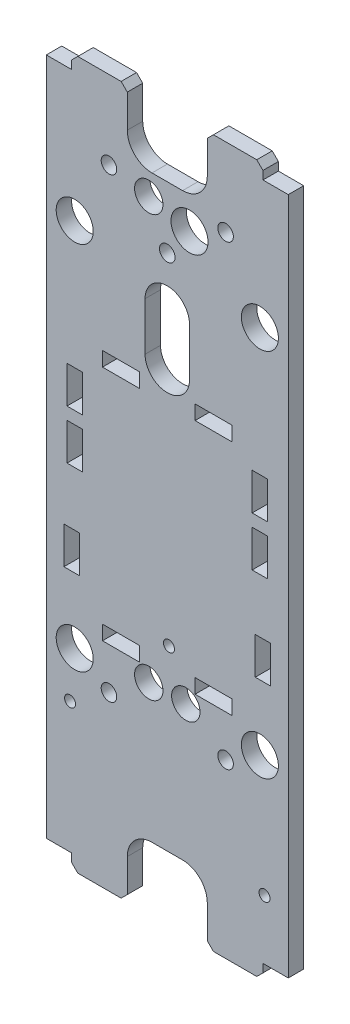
SolidWorks part; units mm, degrees
ref_plane "Front Plane" through (0, 0, 0) normal (0, 0, 1) x (1, 0, 0)
ref_plane "Top Plane" through (0, 0, 0) normal (0, 1, 0) x (1, 0, 0)
ref_plane "Right Plane" through (0, 0, 0) normal (1, 0, 0) x (0, 0, -1)
sketch "Sketch1" plane through (0, 0, 0) normal (0, 0, 1) x (1, 0, 0)
  line L1 (-24.892, 72.771) -> (24.892, 72.771)
  line L2 (-24.892, 72.771) -> (-24.892, -72.771)
  line L3 (-24.892, -72.771) -> (24.892, -72.771)
  line L4 (24.892, 72.771) -> (24.892, -72.771)
  line L5 (-24.892, 72.771) -> (24.892, -72.771) construction
  line L6 (-24.892, -72.771) -> (24.892, 72.771) construction
  point P0 (0, 0)
  dimension "D1" = 49.784
  dimension "D2" = 145.542
extrude "Boss-Extrude1" add sketch "Sketch1" along normal blind 3.175
sketch "Sketch2" plane through (0, 0, 0) normal (0, 0, -1) x (-1, 0, 0)
  line L0 (-24.892, 72.771) -> (24.892, 72.771) construction
  line L1 (-8.2296, 75.7428) -> (8.2296, 75.7428)
  line L2 (-8.2296, 75.7428) -> (-8.2296, 69.7992)
  line L3 (-8.2296, 69.7992) -> (8.2296, 69.7992)
  line L4 (8.2296, 75.7428) -> (8.2296, 69.7992)
  line L5 (-8.2296, 75.7428) -> (8.2296, 69.7992) construction
  line L6 (-8.2296, 69.7992) -> (8.2296, 75.7428) construction
  line L7 (0, 72.771) -> (0, -72.771) construction
  line L8 (-30.099, 75.7428) -> (-19.685, 75.7428)
  line L9 (-30.099, 75.7428) -> (-30.099, 69.7992)
  line L10 (-30.099, 69.7992) -> (-19.685, 69.7992)
  line L11 (-19.685, 75.7428) -> (-19.685, 69.7992)
  line L12 (-30.099, 75.7428) -> (-19.685, 69.7992) construction
  line L13 (-30.099, 69.7992) -> (-19.685, 75.7428) construction
  line L14 (24.892, -72.771) -> (-24.892, -72.771) construction
  line L15 (-24.892, 0) -> (24.892, 0) construction
  line L16 (-24.892, -72.771) -> (-24.892, 72.771) construction
  line L17 (24.892, 72.771) -> (24.892, -72.771) construction
  line L18 (30.099, 69.7992) -> (19.685, 75.7428) construction
  line L19 (30.099, 75.7428) -> (19.685, 69.7992) construction
  line L20 (19.685, 75.7428) -> (19.685, 69.7992)
  line L21 (30.099, 69.7992) -> (19.685, 69.7992)
  line L22 (30.099, 75.7428) -> (30.099, 69.7992)
  line L23 (30.099, 75.7428) -> (19.685, 75.7428)
  line L24 (30.099, -75.7428) -> (19.685, -69.7992) construction
  line L25 (30.099, -69.7992) -> (19.685, -75.7428) construction
  line L26 (-30.099, -69.7992) -> (-19.685, -75.7428) construction
  line L27 (-30.099, -75.7428) -> (-19.685, -69.7992) construction
  line L28 (-8.2296, -69.7992) -> (8.2296, -75.7428) construction
  line L29 (-8.2296, -75.7428) -> (8.2296, -69.7992) construction
  line L30 (30.099, -75.7428) -> (19.685, -75.7428)
  line L31 (30.099, -75.7428) -> (30.099, -69.7992)
  line L32 (30.099, -69.7992) -> (19.685, -69.7992)
  line L33 (19.685, -75.7428) -> (19.685, -69.7992)
  line L34 (-19.685, -75.7428) -> (-19.685, -69.7992)
  line L35 (-30.099, -69.7992) -> (-19.685, -69.7992)
  line L36 (-30.099, -75.7428) -> (-30.099, -69.7992)
  line L37 (-30.099, -75.7428) -> (-19.685, -75.7428)
  line L38 (8.2296, -75.7428) -> (8.2296, -69.7992)
  line L39 (-8.2296, -69.7992) -> (8.2296, -69.7992)
  line L40 (-8.2296, -75.7428) -> (-8.2296, -69.7992)
  line L41 (-8.2296, -75.7428) -> (8.2296, -75.7428)
  point P0 (0, 72.771)
  point P7 (-24.892, 72.771)
  point P27 (24.892, 72.771)
  point P40 (24.892, -72.771)
  point P41 (-24.892, -72.771)
  point P42 (0, -72.771)
extrude "Cut-Extrude1" cut sketch "Sketch2" against normal through all
sketch "Sketch3" plane through (0, 0, 0) normal (0, 0, -1) x (-1, 0, 0)
  line L0 (0, 69.7992) -> (0, -69.7992) construction
  line L1 (-8.2296, 69.7992) -> (8.2296, 69.7992) construction
  line L2 (8.2296, -69.7992) -> (-8.2296, -69.7992) construction
  line L3 (-24.892, 0) -> (24.892, 0) construction
  line L4 (-24.892, -69.7992) -> (-24.892, 69.7992) construction
  line L5 (24.892, 69.7992) -> (24.892, -69.7992) construction
  line L6 (-8.2296, -59.6392) -> (8.2296, -79.9592) construction
  line L7 (-8.2296, 79.9592) -> (8.2296, 79.9592)
  line L8 (-8.2296, 79.9592) -> (-8.2296, 64.7192)
  line L9 (-3.1496, 59.6392) -> (3.1496, 59.6392)
  line L10 (8.2296, 79.9592) -> (8.2296, 64.7192)
  line L11 (-8.2296, 79.9592) -> (8.2296, 59.6392) construction
  line L12 (-8.2296, 59.6392) -> (8.2296, 79.9592) construction
  line L13 (-8.2296, -79.9592) -> (8.2296, -59.6392) construction
  line L14 (8.2296, -79.9592) -> (8.2296, -64.7192)
  line L15 (-3.1496, -59.6392) -> (3.1496, -59.6392)
  line L16 (-8.2296, -79.9592) -> (-8.2296, -64.7192)
  line L17 (-8.2296, -79.9592) -> (8.2296, -79.9592)
  arc A0 (-8.2296, 64.7192) -> (-3.1496, 59.6392) centre (-3.1496, 64.7192) ccw
  arc A1 (3.1496, 59.6392) -> (8.2296, 64.7192) centre (3.1496, 64.7192) ccw
  arc A2 (3.1496, -59.6392) -> (8.2296, -64.7192) centre (3.1496, -64.7192) cw
  arc A3 (-8.2296, -64.7192) -> (-3.1496, -59.6392) centre (-3.1496, -64.7192) cw
  dimension "D3" = 5.08
  dimension "D4" = 5.08
  dimension "D1" = 20.32
  dimension "D2" = 16.4592
extrude "Cut-Extrude2" cut sketch "Sketch3" against normal through all
hole_wizard "M3 Clearance Hole1" positions "Sketch6" profile "Sketch5" hole size "M3" standard "ANSI Metric"
sketch "Sketch6" plane through (0, 0, 3.175) normal (0, 0, 1) x (1, 0, 0)
  line L0 (0, 59.6392) -> (0, -59.6392) construction
  line L1 (3.1496, 59.6392) -> (-3.1496, 59.6392) construction
  line L2 (-3.1496, -59.6392) -> (3.1496, -59.6392) construction
  line L4 (-24.892, 59.6392) -> (24.892, 59.6392) construction
  line L5 (-24.892, 69.7992) -> (-24.892, -69.7992) construction
  line L6 (24.892, -69.7992) -> (24.892, 69.7992) construction
  point P17 (-12, 56.6392)
  point P19 (12, 56.6392)
  point P21 (12, -37.3608)
  point P23 (-12, -37.3608)
  point P26 (0, 46.9392)
  point P30 (0, 0)
  dimension "D1" = 3
  dimension "D2" = 3
  dimension "D3" = 12
  dimension "D4" = 12
  dimension "D5" = 94
  dimension "D6" = 94
  dimension "D7" = 12
  dimension "D8" = 12
  dimension "D9" = 12.7
sketch "Sketch5" plane through (0, 46.9392, 3.175) normal (1, 0, 0) x (0, -1, 0)
  line L0 (0, 0) -> (0, 3.175)
  line L1 (0, 3.175) -> (1.6, 3.175)
  line L2 (1.6, 3.175) -> (1.6, 0)
  line L5 (1.6, 0) -> (0, 0)
  line L11 (0, -6.35) -> (0, 107.95) construction
  dimension "Thru Hole Dia." = 3.2
  dimension "Thru Hole Depth" = 3.175
hole_wizard "Tap Drill for #4-40 Tap1" positions "Sketch15" profile "Sketch16" hole size "#4-40" standard "ANSI Inch"
sketch "Sketch15" plane through (0, 0, 3.175) normal (0, 0, 1) x (1, 0, 0)
  line L1 (0, 0) -> (0.7916, -52.05) construction
  circle A0 centre (0, 46.9392) radius 1.6 construction
  point P8 (0.3484, -22.9108)
  dimension "D1" = 69.85
sketch "Sketch16" plane through (0.3484, -22.9108, 3.175) normal (1, 0, 0) x (0, -1, 0)
  line L0 (0, 0) -> (0, 3.175)
  line L1 (0, 3.175) -> (1.1303, 3.175)
  line L2 (1.1303, 3.175) -> (1.1303, 0)
  line L5 (1.1303, 0) -> (0, 0)
  line L11 (0, -6.35) -> (0, 107.95) construction
  dimension "Thru Hole Dia." = 2.2606
  dimension "Thru Hole Depth" = 3.175
hole_wizard "#2 Clearance Hole1" positions "Sketch7" profile "Sketch8" hole size "#2" standard "ANSI Inch"
sketch "Sketch7" plane through (0, 0, 3.175) normal (0, 0, 1) x (1, 0, 0)
  line L0 (-24.892, -59.436) -> (24.892, -59.436) construction
  line L1 (-24.892, 69.7992) -> (-24.892, -69.7992) construction
  line L2 (24.892, -69.7992) -> (24.892, 69.7992) construction
  line L4 (0, -59.436) -> (0, 59.6392) construction
  line L5 (3.1496, 59.6392) -> (-3.1496, 59.6392) construction
  point P15 (-20.005, -42.916)
  point P17 (20.005, -57.526)
sketch "Sketch8" plane through (20.005, -57.526, 3.175) normal (1, 0, 0) x (0, -1, 0)
  line L0 (0, 0) -> (0, 3.175)
  line L1 (0, 3.175) -> (1.1303, 3.175)
  line L2 (1.1303, 3.175) -> (1.1303, 0)
  line L5 (1.1303, 0) -> (0, 0)
  line L11 (0, -6.35) -> (0, 107.95) construction
  dimension "Thru Hole Dia." = 2.2606
  dimension "Thru Hole Depth" = 3.175
sketch "Sketch9" plane through (0, 0, 3.175) normal (0, 0, 1) x (1, 0, 0)
  line L0 (0, 59.6392) -> (0, -59.6392) construction
  line L1 (3.1496, 59.6392) -> (-3.1496, 59.6392) construction
  line L2 (-3.1496, -59.6392) -> (3.1496, -59.6392) construction
  line L3 (-24.892, 8.0853) -> (24.892, 8.0853) construction
  line L4 (-24.892, 69.7992) -> (-24.892, -69.7992) construction
  line L5 (24.892, -69.7992) -> (24.892, 69.7992) construction
  line L6 (-24.892, 21.4324) -> (24.892, 21.4324) construction
  line L7 (-20.6375, 16.9753) -> (-17.4625, 16.9753)
  line L8 (-20.6375, 16.9753) -> (-20.6375, 9.3553)
  line L9 (-20.6375, 9.3553) -> (-17.4625, 9.3553)
  line L10 (-17.4625, 16.9753) -> (-17.4625, 9.3553)
  line L11 (-20.6375, 16.9753) -> (-17.4625, 9.3553) construction
  line L12 (-20.6375, 9.3553) -> (-17.4625, 16.9753) construction
  line L18 (-13.335, 22.9183) -> (-5.715, 22.9183)
  line L19 (-13.335, 22.9183) -> (-13.335, 19.9465)
  line L20 (20.6375, 9.3553) -> (17.4625, 16.9753) construction
  line L21 (20.6375, 16.9753) -> (17.4625, 9.3553) construction
  line L26 (17.4625, 16.9753) -> (17.4625, 9.3553)
  line L27 (20.6375, 9.3553) -> (17.4625, 9.3553)
  line L28 (20.6375, 16.9753) -> (20.6375, 9.3553)
  line L29 (20.6375, 16.9753) -> (17.4625, 16.9753)
  line L30 (20.6375, -0.8047) -> (17.4625, 6.8153) construction
  line L31 (20.6375, 6.8153) -> (17.4625, -0.8047) construction
  line L32 (-13.335, 19.9465) -> (-5.715, 19.9465)
  line L33 (-5.715, 22.9183) -> (-5.715, 19.9465)
  line L34 (-13.335, 22.9183) -> (-5.715, 19.9465) construction
  line L35 (-20.6375, 6.8153) -> (-17.4625, -0.8047) construction
  line L36 (-20.6375, -0.8047) -> (-17.4625, 6.8153) construction
  line L37 (-13.335, 19.9465) -> (-5.715, 22.9183) construction
  line L38 (0, -43.4686) -> (0, 75.8098) construction
  line L39 (20.6375, -0.8047) -> (17.4625, -0.8047)
  line L40 (20.6375, -0.8047) -> (20.6375, 6.8153)
  line L41 (20.6375, 6.8153) -> (17.4625, 6.8153)
  line L42 (17.4625, -0.8047) -> (17.4625, 6.8153)
  line L51 (-17.4625, -0.8047) -> (-17.4625, 6.8153)
  line L52 (-20.6375, 6.8153) -> (-17.4625, 6.8153)
  line L53 (-20.6375, -0.8047) -> (-20.6375, 6.8153)
  line L54 (-20.6375, -0.8047) -> (-17.4625, -0.8047)
  line L55 (5.715, 22.9183) -> (13.335, 22.9183)
  line L56 (5.715, 22.9183) -> (5.715, 19.9465)
  line L57 (5.715, 19.9465) -> (13.335, 19.9465)
  line L58 (13.335, 22.9183) -> (13.335, 19.9465)
  line L59 (5.715, 22.9183) -> (13.335, 19.9465) construction
  line L60 (5.715, 19.9465) -> (13.335, 22.9183) construction
  point P12 (-19.05, 13.1653)
  point P17 (9.525, 21.4324)
  point P18 (-9.525, 21.4324)
  point P31 (19.05, 13.1653)
  point P50 (19.05, 3.0053)
  point P53 (-19.05, 3.0053)
extrude "Cut-Extrude3" cut sketch "Sketch9" against normal through all
sketch "Sketch10" plane through (0, 0, 3.175) normal (0, 0, 1) x (1, 0, 0)
  line L0 (0, 59.6392) -> (0, -9.1192) construction
  line L1 (3.1496, 59.6392) -> (-3.1496, 59.6392) construction
  line L2 (0, 36.5252) -> (0, 26.6192) construction
  line L3 (4.572, 36.5252) -> (4.572, 26.6192)
  line L4 (-4.572, 36.5252) -> (-4.572, 26.6192)
  arc A0 (4.572, 36.5252) -> (-4.572, 36.5252) centre (0, 36.5252) ccw
  arc A1 (-4.572, 26.6192) -> (4.572, 26.6192) centre (0, 26.6192) ccw
  circle A2 centre (0, 46.9392) radius 1.6 construction
  point P7 (0, 31.5722)
extrude "Cut-Extrude4" cut sketch "Sketch10" against normal through all
sketch "Sketch11" plane through (0, 0, 3.175) normal (0, 0, 1) x (1, 0, 0)
  line L0 (0, 59.6392) -> (0, -58.8932) construction
  line L1 (3.1496, 59.6392) -> (-3.1496, 59.6392) construction
  line L3 (24.892, -69.7992) -> (24.892, 69.7992) construction
  line L4 (24.892, 46.736) -> (-24.892, 46.736) construction
  line L5 (-24.892, 69.7992) -> (-24.892, -69.7992) construction
  line L7 (24.892, -23.114) -> (-24.892, -23.114) construction
  circle A0 centre (4.572, 53.086) radius 3.81
  circle A1 centre (-3.81, 55.118) radius 2.921
  circle A2 centre (3.81, -31.496) radius 2.921
  circle A3 centre (-3.81, -31.496) radius 2.921
  dimension "D1" = 5.842
  dimension "D2" = 5.842
  dimension "D7" = 7.62
  dimension "D8" = 5.842
  dimension "D3" = 8.382
  dimension "D4" = 8.382
  dimension "D5" = 3.81
  dimension "D6" = 3.81
  dimension "D9" = 8.382
  dimension "D10" = 3.81
  dimension "D11" = 6.35
  dimension "D12" = 4.572
extrude "Cut-Extrude5" cut sketch "Sketch11" against normal through all
sketch "Sketch12" plane through (0, 0, 3.175) normal (0, 0, 1) x (1, 0, 0)
  line L0 (0, 59.6392) -> (0, -59.0729) construction
  line L1 (3.1496, 59.6392) -> (-3.1496, 59.6392) construction
  line L2 (-24.892, 0) -> (24.892, 0) construction
  line L3 (-24.892, 69.7992) -> (-24.892, -69.7992) construction
  line L4 (24.892, -69.7992) -> (24.892, 69.7992) construction
  circle A0 centre (19.05, 43.18) radius 3.81
  circle A1 centre (-19.05, 43.18) radius 3.81
  circle A2 centre (19.05, -33.02) radius 3.81
  circle A3 centre (-19.05, -33.02) radius 3.81
  dimension "D1" = 7.62
  dimension "D2" = 7.62
  dimension "D3" = 7.62
  dimension "D4" = 7.62
  dimension "D5" = 19.05
  dimension "D6" = 19.05
  dimension "D7" = 19.05
  dimension "D8" = 19.05
  dimension "D9" = 43.18
  dimension "D10" = 43.18
  dimension "D11" = 33.02
  dimension "D12" = 33.02
extrude "Cut-Extrude6" cut sketch "Sketch12" against normal through all
sketch "Sketch13" plane through (0, 0, 3.175) normal (0, 0, 1) x (1, 0, 0)
  line L0 (0, 59.6392) -> (0, -59.6392) construction
  line L1 (3.1496, 59.6392) -> (-3.1496, 59.6392) construction
  line L2 (-3.1496, -59.6392) -> (3.1496, -59.6392) construction
  line L3 (-24.892, -15.7856) -> (24.892, -15.7856) construction
  line L4 (-24.892, 69.7992) -> (-24.892, -69.7992) construction
  line L5 (24.892, -69.7992) -> (24.892, 69.7992) construction
  line L6 (24.892, -27.336) -> (-24.892, -27.336) construction
  line L7 (-21.2725, -11.9756) -> (-18.0975, -11.9756)
  line L8 (-21.2725, -11.9756) -> (-21.2725, -19.5956)
  line L9 (-21.2725, -19.5956) -> (-18.0975, -19.5956)
  line L10 (-18.0975, -11.9756) -> (-18.0975, -19.5956)
  line L11 (-21.2725, -11.9756) -> (-18.0975, -19.5956) construction
  line L12 (-21.2725, -19.5956) -> (-18.0975, -11.9756) construction
  line L18 (5.715, -25.8501) -> (13.335, -25.8501)
  line L19 (5.715, -25.8501) -> (5.715, -28.8219)
  line L20 (21.2725, -19.5956) -> (18.0975, -11.9756) construction
  line L21 (21.2725, -11.9756) -> (18.0975, -19.5956) construction
  line L26 (18.0975, -11.9756) -> (18.0975, -19.5956)
  line L27 (21.2725, -19.5956) -> (18.0975, -19.5956)
  line L28 (21.2725, -11.9756) -> (21.2725, -19.5956)
  line L29 (21.2725, -11.9756) -> (18.0975, -11.9756)
  line L30 (5.715, -28.8219) -> (13.335, -28.8219)
  line L31 (13.335, -25.8501) -> (13.335, -28.8219)
  line L32 (5.715, -25.8501) -> (13.335, -28.8219) construction
  line L33 (5.715, -28.8219) -> (13.335, -25.8501) construction
  line L34 (-13.335, -25.8501) -> (-5.715, -25.8501)
  line L35 (-13.335, -25.8501) -> (-13.335, -28.8219)
  line L36 (-13.335, -28.8219) -> (-5.715, -28.8219)
  line L37 (-5.715, -25.8501) -> (-5.715, -28.8219)
  line L38 (-13.335, -25.8501) -> (-5.715, -28.8219) construction
  line L39 (-13.335, -28.8219) -> (-5.715, -25.8501) construction
  point P12 (-19.685, -15.7856)
  point P19 (9.525, -27.336)
  point P24 (-9.525, -27.336)
  point P31 (19.685, -15.7856)
extrude "Cut-Extrude7" cut sketch "Sketch13" against normal through all
chamfer "Chamfer1" distance 1.27 8 edges at (-19.685, 72.771, 1.5875) (8.2296, 72.771, 1.5875) (19.685, 72.771, 1.5875) (-19.685, -72.771, 1.5875) (-8.2296, -72.771, 1.5875) (19.685, -72.771, 1.5875) (8.2296, -72.771, 1.5875) (-8.2296, 72.771, 1.5875)
sketch "Sketch17" plane through (0, 0, 3.175) normal (0, 0, 1) x (1, 0, 0)
  line L32 (-4.4704, 36.5252) -> (-4.4704, 26.6192)
  line L33 (4.4704, 26.6192) -> (4.4704, 36.5252)
  line L34 (-4.4704, 36.5252) -> (-4.4704, 26.6192)
  line L35 (4.4704, 26.6192) -> (4.4704, 36.5252)
  line L42 (-5.8166, 20.0481) -> (-5.8166, 22.8167)
  line L43 (-5.8166, 22.8167) -> (-13.2334, 22.8167)
  line L44 (-13.2334, 22.8167) -> (-13.2334, 20.0481)
  line L45 (-13.2334, 20.0481) -> (-5.8166, 20.0481)
  line L46 (-5.8166, 20.0481) -> (-5.8166, 22.8167)
  line L47 (-5.8166, 22.8167) -> (-13.2334, 22.8167)
  line L48 (-13.2334, 22.8167) -> (-13.2334, 20.0481)
  line L49 (-13.2334, 20.0481) -> (-5.8166, 20.0481)
  line L54 (13.2334, 20.0481) -> (13.2334, 22.8167)
  line L55 (5.8166, 20.0481) -> (13.2334, 20.0481)
  line L56 (-8.128, 64.7192) -> (-8.128, 71.5431)
  line L57 (-8.128, 71.5431) -> (-9.4575, 72.8726)
  line L58 (-9.4575, 72.8726) -> (-18.4571, 72.8726)
  line L59 (-18.4571, 72.8726) -> (-19.7866, 71.5431)
  line L60 (-19.7866, 71.5431) -> (-19.7866, 69.9008)
  line L61 (-19.7866, 69.9008) -> (-24.9936, 69.9008)
  line L62 (-24.9936, 69.9008) -> (-24.9936, -69.9008)
  line L63 (-24.9936, -69.9008) -> (-19.7866, -69.9008)
  line L64 (-19.7866, -69.9008) -> (-19.7866, -71.5431)
  line L65 (-19.7866, -71.5431) -> (-18.4571, -72.8726)
  line L66 (-18.4571, -72.8726) -> (-9.4575, -72.8726)
  line L67 (-9.4575, -72.8726) -> (-8.128, -71.5431)
  line L68 (-8.128, -71.5431) -> (-8.128, -64.7192)
  line L69 (-3.1496, -59.7408) -> (3.1496, -59.7408)
  line L70 (8.128, -64.7192) -> (8.128, -71.5431)
  line L71 (8.128, -71.5431) -> (9.4575, -72.8726)
  line L72 (9.4575, -72.8726) -> (18.4571, -72.8726)
  line L73 (18.4571, -72.8726) -> (19.7866, -71.5431)
  line L74 (19.7866, -71.5431) -> (19.7866, -69.9008)
  line L75 (19.7866, -69.9008) -> (24.9936, -69.9008)
  line L76 (24.9936, -69.9008) -> (24.9936, 69.9008)
  line L77 (24.9936, 69.9008) -> (19.7866, 69.9008)
  line L78 (19.7866, 69.9008) -> (19.7866, 71.5431)
  line L79 (19.7866, 71.5431) -> (18.4571, 72.8726)
  line L80 (18.4571, 72.8726) -> (9.4575, 72.8726)
  line L81 (9.4575, 72.8726) -> (8.128, 71.5431)
  line L82 (8.128, 71.5431) -> (8.128, 64.7192)
  line L83 (3.1496, 59.7408) -> (-3.1496, 59.7408)
  line L84 (-8.128, 64.7192) -> (-8.128, 71.5431)
  line L85 (-8.128, 71.5431) -> (-9.4575, 72.8726)
  line L86 (-9.4575, 72.8726) -> (-18.4571, 72.8726)
  line L87 (-18.4571, 72.8726) -> (-19.7866, 71.5431)
  line L88 (-19.7866, 71.5431) -> (-19.7866, 69.9008)
  line L89 (-19.7866, 69.9008) -> (-24.9936, 69.9008)
  line L90 (-24.9936, 69.9008) -> (-24.9936, -69.9008)
  line L91 (-24.9936, -69.9008) -> (-19.7866, -69.9008)
  line L92 (-19.7866, -69.9008) -> (-19.7866, -71.5431)
  line L93 (-19.7866, -71.5431) -> (-18.4571, -72.8726)
  line L94 (-18.4571, -72.8726) -> (-9.4575, -72.8726)
  line L95 (-9.4575, -72.8726) -> (-8.128, -71.5431)
  line L96 (-8.128, -71.5431) -> (-8.128, -64.7192)
  line L97 (-3.1496, -59.7408) -> (3.1496, -59.7408)
  line L98 (8.128, -64.7192) -> (8.128, -71.5431)
  line L99 (8.128, -71.5431) -> (9.4575, -72.8726)
  line L100 (9.4575, -72.8726) -> (18.4571, -72.8726)
  line L101 (18.4571, -72.8726) -> (19.7866, -71.5431)
  line L102 (19.7866, -71.5431) -> (19.7866, -69.9008)
  line L103 (19.7866, -69.9008) -> (24.9936, -69.9008)
  line L104 (24.9936, -69.9008) -> (24.9936, 69.9008)
  line L105 (24.9936, 69.9008) -> (19.7866, 69.9008)
  line L106 (19.7866, 69.9008) -> (19.7866, 71.5431)
  line L107 (19.7866, 71.5431) -> (18.4571, 72.8726)
  line L108 (18.4571, 72.8726) -> (9.4575, 72.8726)
  line L109 (9.4575, 72.8726) -> (8.128, 71.5431)
  line L110 (8.128, 71.5431) -> (8.128, 64.7192)
  line L111 (3.1496, 59.7408) -> (-3.1496, 59.7408)
  line L112 (5.8166, 22.8167) -> (5.8166, 20.0481)
  line L113 (13.2334, 22.8167) -> (5.8166, 22.8167)
  line L114 (13.2334, 20.0481) -> (13.2334, 22.8167)
  line L115 (5.8166, 20.0481) -> (13.2334, 20.0481)
  line L116 (5.8166, 22.8167) -> (5.8166, 20.0481)
  line L117 (13.2334, 22.8167) -> (5.8166, 22.8167)
  line L122 (-20.5359, 9.4569) -> (-17.5641, 9.4569)
  line L123 (-20.5359, 16.8737) -> (-20.5359, 9.4569)
  line L124 (-17.5641, 16.8737) -> (-20.5359, 16.8737)
  line L125 (-17.5641, 9.4569) -> (-17.5641, 16.8737)
  line L126 (-20.5359, 9.4569) -> (-17.5641, 9.4569)
  line L127 (-20.5359, 16.8737) -> (-20.5359, 9.4569)
  line L128 (-17.5641, 16.8737) -> (-20.5359, 16.8737)
  line L129 (-17.5641, 9.4569) -> (-17.5641, 16.8737)
  line L134 (-20.5359, -0.7031) -> (-17.5641, -0.7031)
  line L135 (-20.5359, 6.7137) -> (-20.5359, -0.7031)
  line L136 (-17.5641, 6.7137) -> (-20.5359, 6.7137)
  line L137 (-17.5641, -0.7031) -> (-17.5641, 6.7137)
  line L138 (-20.5359, -0.7031) -> (-17.5641, -0.7031)
  line L139 (-20.5359, 6.7137) -> (-20.5359, -0.7031)
  line L140 (-17.5641, 6.7137) -> (-20.5359, 6.7137)
  line L141 (-17.5641, -0.7031) -> (-17.5641, 6.7137)
  line L146 (17.5641, 9.4569) -> (20.5359, 9.4569)
  line L147 (17.5641, 16.8737) -> (17.5641, 9.4569)
  line L148 (20.5359, 16.8737) -> (17.5641, 16.8737)
  line L149 (20.5359, 9.4569) -> (20.5359, 16.8737)
  line L150 (17.5641, 9.4569) -> (20.5359, 9.4569)
  line L151 (17.5641, 16.8737) -> (17.5641, 9.4569)
  line L152 (20.5359, 16.8737) -> (17.5641, 16.8737)
  line L153 (20.5359, 9.4569) -> (20.5359, 16.8737)
  line L158 (17.5641, -0.7031) -> (20.5359, -0.7031)
  line L159 (17.5641, 6.7137) -> (17.5641, -0.7031)
  line L160 (20.5359, -0.7031) -> (20.5359, 6.7137)
  line L161 (20.5359, 6.7137) -> (17.5641, 6.7137)
  line L162 (17.5641, -0.7031) -> (20.5359, -0.7031)
  line L163 (17.5641, 6.7137) -> (17.5641, -0.7031)
  line L164 (20.5359, -0.7031) -> (20.5359, 6.7137)
  line L165 (20.5359, 6.7137) -> (17.5641, 6.7137)
  line L170 (-21.1709, -19.494) -> (-18.1991, -19.494)
  line L171 (-21.1709, -12.0772) -> (-21.1709, -19.494)
  line L172 (-18.1991, -12.0772) -> (-21.1709, -12.0772)
  line L173 (-18.1991, -19.494) -> (-18.1991, -12.0772)
  line L174 (-21.1709, -19.494) -> (-18.1991, -19.494)
  line L175 (-21.1709, -12.0772) -> (-21.1709, -19.494)
  line L176 (-18.1991, -12.0772) -> (-21.1709, -12.0772)
  line L177 (-18.1991, -19.494) -> (-18.1991, -12.0772)
  line L182 (-13.2334, -25.9517) -> (-13.2334, -28.7203)
  line L183 (-13.2334, -28.7203) -> (-5.8166, -28.7203)
  line L184 (-5.8166, -28.7203) -> (-5.8166, -25.9517)
  line L185 (-5.8166, -25.9517) -> (-13.2334, -25.9517)
  line L186 (-13.2334, -25.9517) -> (-13.2334, -28.7203)
  line L187 (-13.2334, -28.7203) -> (-5.8166, -28.7203)
  line L188 (-5.8166, -28.7203) -> (-5.8166, -25.9517)
  line L189 (-5.8166, -25.9517) -> (-13.2334, -25.9517)
  line L194 (5.8166, -28.7203) -> (13.2334, -28.7203)
  line L195 (13.2334, -28.7203) -> (13.2334, -25.9517)
  line L196 (5.8166, -25.9517) -> (5.8166, -28.7203)
  line L197 (13.2334, -25.9517) -> (5.8166, -25.9517)
  line L198 (5.8166, -28.7203) -> (13.2334, -28.7203)
  line L199 (13.2334, -28.7203) -> (13.2334, -25.9517)
  line L200 (5.8166, -25.9517) -> (5.8166, -28.7203)
  line L201 (13.2334, -25.9517) -> (5.8166, -25.9517)
  line L206 (18.1991, -19.494) -> (21.1709, -19.494)
  line L207 (21.1709, -19.494) -> (21.1709, -12.0772)
  line L208 (18.1991, -12.0772) -> (18.1991, -19.494)
  line L209 (21.1709, -12.0772) -> (18.1991, -12.0772)
  line L210 (18.1991, -19.494) -> (21.1709, -19.494)
  line L211 (21.1709, -19.494) -> (21.1709, -12.0772)
  line L212 (18.1991, -12.0772) -> (18.1991, -19.494)
  line L213 (21.1709, -12.0772) -> (18.1991, -12.0772)
  circle A6 centre (-12, 56.6392) radius 1.4984
  circle A7 centre (-12, 56.6392) radius 1.4984
  arc A8 (-3.1496, -59.7408) -> (-8.128, -64.7192) centre (-3.1496, -64.7192) ccw
  arc A9 (8.128, -64.7192) -> (3.1496, -59.7408) centre (3.1496, -64.7192) ccw
  arc A10 (3.1496, 59.7408) -> (8.128, 64.7192) centre (3.1496, 64.7192) ccw
  arc A11 (-8.128, 64.7192) -> (-3.1496, 59.7408) centre (-3.1496, 64.7192) ccw
  arc A12 (-3.1496, -59.7408) -> (-8.128, -64.7192) centre (-3.1496, -64.7192) ccw
  arc A13 (8.128, -64.7192) -> (3.1496, -59.7408) centre (3.1496, -64.7192) ccw
  arc A14 (3.1496, 59.7408) -> (8.128, 64.7192) centre (3.1496, 64.7192) ccw
  arc A15 (-8.128, 64.7192) -> (-3.1496, 59.7408) centre (-3.1496, 64.7192) ccw
  circle A17 centre (-3.81, 55.118) radius 2.8194
  circle A18 centre (-3.81, 55.118) radius 2.8194
  circle A20 centre (4.572, 53.086) radius 3.7084
  circle A21 centre (4.572, 53.086) radius 3.7084
  circle A23 centre (12, 56.6392) radius 1.4984
  circle A24 centre (12, 56.6392) radius 1.4984
  circle A26 centre (0, 46.9392) radius 1.4984
  circle A27 centre (0, 46.9392) radius 1.4984
  circle A29 centre (-19.05, 43.18) radius 3.7084
  circle A30 centre (-19.05, 43.18) radius 3.7084
  circle A32 centre (19.05, 43.18) radius 3.7084
  circle A33 centre (19.05, 43.18) radius 3.7084
  arc A37 (-4.4704, 26.6192) -> (4.4704, 26.6192) centre (0, 26.6192) ccw
  arc A38 (4.4704, 36.5252) -> (-4.4704, 36.5252) centre (0, 36.5252) ccw
  arc A39 (-4.4704, 26.6192) -> (4.4704, 26.6192) centre (0, 26.6192) ccw
  arc A40 (4.4704, 36.5252) -> (-4.4704, 36.5252) centre (0, 36.5252) ccw
  circle A41 centre (0.3484, -22.9108) radius 1.0287
  circle A42 centre (0.3484, -22.9108) radius 1.0287
  circle A44 centre (-3.81, -31.496) radius 2.8194
  circle A45 centre (-3.81, -31.496) radius 2.8194
  circle A47 centre (3.81, -31.496) radius 2.8194
  circle A48 centre (3.81, -31.496) radius 2.8194
  circle A50 centre (-19.05, -33.02) radius 3.7084
  circle A51 centre (-19.05, -33.02) radius 3.7084
  circle A53 centre (-12, -37.3608) radius 1.4984
  circle A54 centre (-12, -37.3608) radius 1.4984
  circle A56 centre (-20.005, -42.916) radius 1.0287
  circle A57 centre (-20.005, -42.916) radius 1.0287
  circle A59 centre (12, -37.3608) radius 1.4984
  circle A60 centre (12, -37.3608) radius 1.4984
  circle A62 centre (19.05, -33.02) radius 3.7084
  circle A63 centre (19.05, -33.02) radius 3.7084
  circle A65 centre (20.005, -57.526) radius 1.0287
  circle A66 centre (20.005, -57.526) radius 1.0287
equation "\"D3@Sketch2\"=.324+.451"
equation "\"D2@Sketch7\"=1.91mm+14.61mm"
equation "\"D2@Sketch10\"=.800-.410"
equation "\"t\"= .117in'plywood thickness"
equation "\"kerf\"= .004in'laser cutter kerf"
equation "\"D2@Sketch2\"=\"t\"*2"
equation "\"D4@Sketch2\"=\"t\"*2"
equation "\"D6@Sketch9\"=\"t\""
equation "\"D5@Sketch9\"=\"t\""
equation "\"D7@Sketch13\"=\"t\""
equation "\"D5@Sketch13\"=\"t\""
equation "\"D1@Sketch17\"=\"kerf\""
equation "\"D2@Sketch17\"=\"kerf\""
equation "\"D6@Sketch17\"=\"kerf\""
equation "\"D7@Sketch17\"=\"kerf\""
equation "\"D3@Sketch17\"=\"kerf\""
equation "\"D4@Sketch17\"=\"kerf\""
equation "\"D5@Sketch17\"=\"kerf\""
equation "\"D8@Sketch17\"=\"kerf\""
equation "\"D9@Sketch17\"=\"kerf\""
equation "\"D10@Sketch17\"=\"kerf\""
equation "\"D11@Sketch17\"=\"kerf\""
equation "\"D14@Sketch17\"=\"kerf\""
equation "\"D15@Sketch17\"=\"kerf\""
equation "\"D12@Sketch17\"=\"kerf\""
equation "\"D13@Sketch17\"=\"kerf\""
equation "\"D16@Sketch17\"=\"kerf\""
equation "\"D18@Sketch17\"=\"kerf\""
equation "\"D20@Sketch17\"=\"kerf\""
equation "\"D19@Sketch17\"=\"kerf\""
equation "\"D17@Sketch17\"=\"kerf\""
equation "\"D23@Sketch17\"=\"kerf\""
equation "\"D24@Sketch17\"=\"kerf\""
equation "\"D21@Sketch17\"=\"kerf\""
equation "\"D22@Sketch17\"=\"kerf\""
equation "\"D25@Sketch17\"=\"kerf\""
equation "\"D28@Sketch17\"=\"kerf\""
equation "\"D26@Sketch17\"=\"kerf\""
equation "\"D27@Sketch17\"=\"kerf\""
